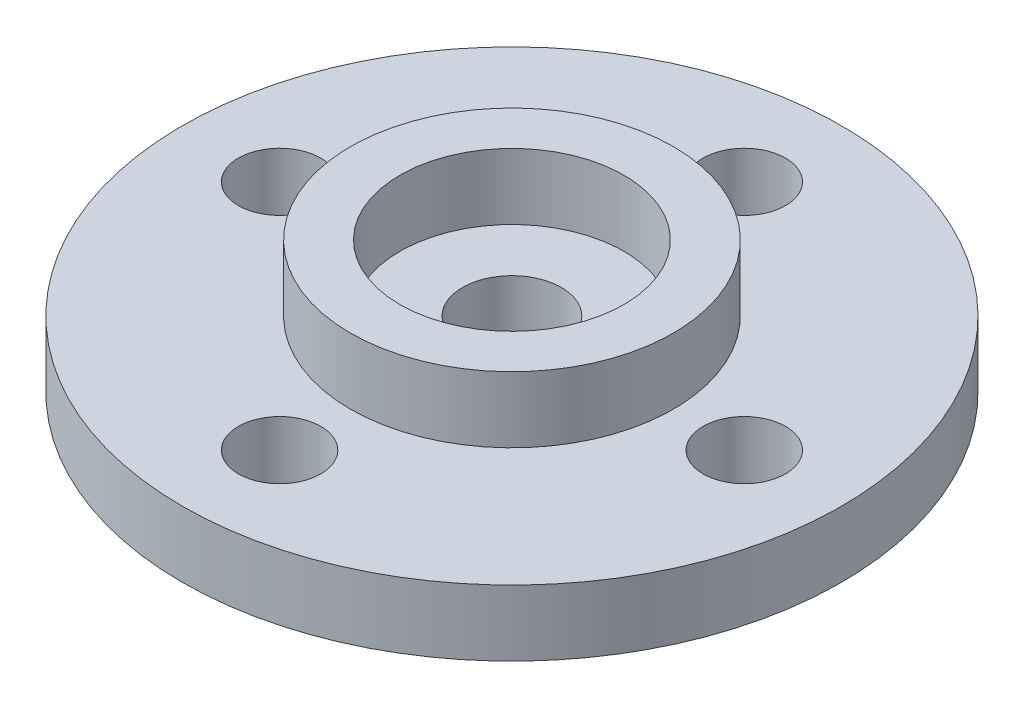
SolidWorks part; units mm, degrees
ref_plane "前视基准面" through (0, 0, 0) normal (0, 0, 1) x (1, 0, 0)
ref_plane "上视基准面" through (0, 0, 0) normal (0, 1, 0) x (1, 0, 0)
ref_plane "右视基准面" through (0, 0, 0) normal (1, 0, 0) x (0, 0, -1)
sketch "草图1" plane through (0, 0, 0) normal (0, 1, 0) x (1, 0, 0)
  circle A0 centre (0, 0) radius 10
extrude "凸台-拉伸1" add sketch "草图1" along normal blind 2
sketch "草图2" plane through (0, 2, 0) normal (0, 1, 0) x (1, 0, 0)
  circle A0 centre (0, 0) radius 4.9
  circle A1 centre (0, 0) radius 3.4
  dimension "D1" = 1.5
extrude "凸台-拉伸2" add sketch "草图2" along normal blind 2
sketch "草图3" plane through (0, 2, 0) normal (0, 1, 0) x (1, 0, 0)
  circle A0 centre (0, 0) radius 7.05 construction
  circle A1 centre (0, 7.05) radius 1.25
  circle A2 centre (7.05, 0) radius 1.25
  circle A3 centre (0, -7.05) radius 1.25
  circle A4 centre (-7.05, 0) radius 1.25
  point P14 (0, 0)
  dimension "D1" = 4
extrude "切除-拉伸1" cut sketch "草图3" against normal blind 2
sketch "草图4" plane through (0, 2, 0) normal (0, 1, 0) x (1, 0, 0)
  circle A0 centre (0, 0) radius 1.5
extrude "切除-拉伸2" cut sketch "草图4" against normal blind 2
